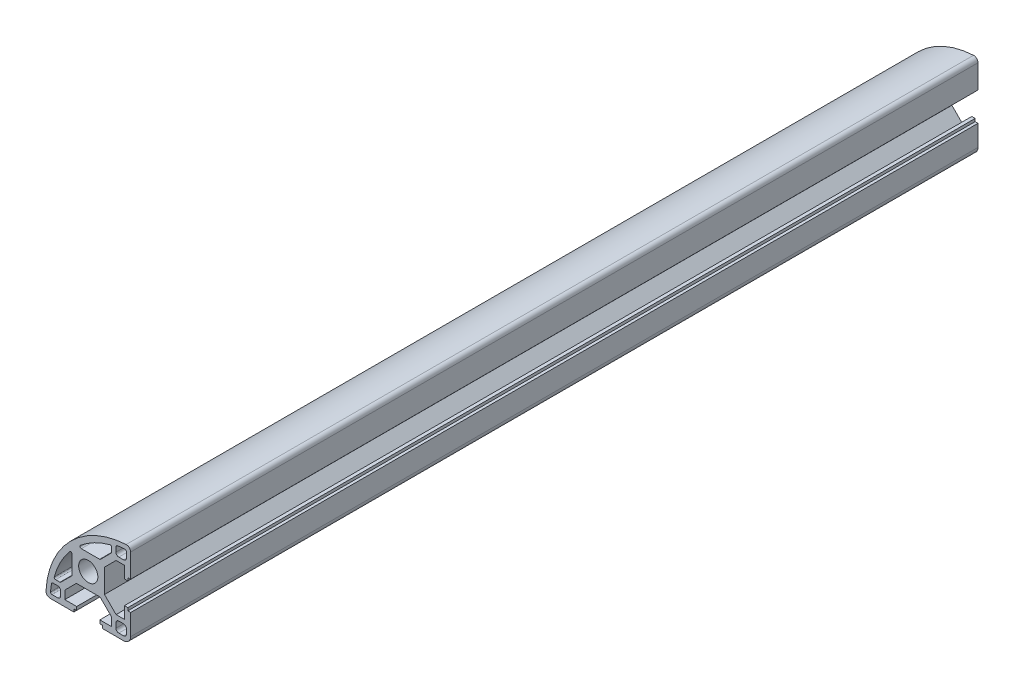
SolidWorks part; units mm, degrees
ref_plane "前视基准面" through (0, 0, 0) normal (0, 0, 1) x (1, 0, 0)
ref_plane "上视基准面" through (0, 0, 0) normal (0, 1, 0) x (1, 0, 0)
ref_plane "右视基准面" through (0, 0, 0) normal (1, 0, 0) x (0, 0, -1)
sketch "草图1" plane through (0, 0, 0) normal (0, 0, 1) x (1, 0, 0)
  line B0 (9.8, -10.8) -> (9.8, -12.5)
  line B1 (10.8, -13.5) -> (12.5, -13.5)
  line B2 (13.5, -12.5) -> (13.5, -10.8)
  line B3 (12.5, -9.8) -> (10.8, -9.8)
  line B4 (-2.4553, 5.75) -> (0, 5.75)
  line B5 (0, 5.75) -> (3.9873, 5.75)
  line B6 (4.3408, 5.8964) -> (8.1536, 9.7092)
  line B7 (8.3, 10.0627) -> (8.3, 11.5407)
  line B8 (9.8, 12.5136) -> (9.8, 10.8)
  line B9 (10.8, 9.8) -> (12.5, 9.8)
  line B10 (13.5, 10.8) -> (13.5, 12.8454)
  line B11 (-11.5407, -8.3) -> (-10.0627, -8.3)
  line B12 (-9.7092, -8.1536) -> (-5.8964, -4.3408)
  line B13 (-5.75, -3.9873) -> (-5.75, 0)
  line B14 (-5.75, 0) -> (-5.75, 2.4553)
  line B15 (-12.8454, -13.5) -> (-10.8, -13.5)
  line B16 (-9.8, -12.5) -> (-9.8, -10.8)
  line B17 (-10.8, -9.8) -> (-12.5136, -9.8)
  line B18 (5.1, -15) -> (12.5, -15)
  line B19 (15, -12.5) -> (15, -5.1)
  line B20 (15, -5.1) -> (14, -5.1)
  line B21 (14, -5.1) -> (14, -4.1)
  line B22 (14, -4.1) -> (12.8, -4.1)
  line B23 (12.8, -4.1) -> (12.8, -8.3)
  line B24 (12.8, -8.3) -> (9.8556, -8.3)
  line B25 (9.8556, -8.3) -> (5.75, -4.1944)
  line B26 (5.75, -4.1944) -> (5.75, 0)
  line B27 (5.75, 0) -> (5.75, 4.1944)
  line B28 (5.75, 4.1944) -> (9.8556, 8.3)
  line B29 (9.8556, 8.3) -> (12.8, 8.3)
  line B30 (12.8, 8.3) -> (12.8, 4.1)
  line B31 (12.8, 4.1) -> (14, 4.1)
  line B32 (14, 4.1) -> (14, 5.1)
  line B33 (14, 5.1) -> (15, 5.1)
  line B34 (15, 5.1) -> (15, 13.4605)
  line B35 (-13.4605, -15) -> (-5.1, -15)
  line B36 (-5.1, -15) -> (-5.1, -14)
  line B37 (-5.1, -14) -> (-4.1, -14)
  line B38 (-4.1, -14) -> (-4.1, -12.8)
  line B39 (-4.1, -12.8) -> (-8.3, -12.8)
  line B40 (-8.3, -12.8) -> (-8.3, -9.8556)
  line B41 (-8.3, -9.8556) -> (-4.1944, -5.75)
  line B42 (-4.1944, -5.75) -> (0, -5.75)
  line B43 (0, -5.75) -> (4.1944, -5.75)
  line B44 (4.1944, -5.75) -> (8.3, -9.8556)
  line B45 (8.3, -9.8556) -> (8.3, -12.8)
  line B46 (8.3, -12.8) -> (4.1, -12.8)
  line B47 (4.1, -12.8) -> (4.1, -14)
  line B48 (4.1, -14) -> (5.1, -14)
  line B49 (5.1, -14) -> (5.1, -15)
  arc B50 (0, 3.4) -> (-3.4, 0) centre (0, 0) ccw
  arc B51 (-3.4, 0) -> (0, -3.4) centre (0, 0) ccw
  arc B52 (0, -3.4) -> (3.4, 0) centre (0, 0) ccw
  arc B53 (3.4, 0) -> (0, 3.4) centre (0, 0) ccw
  arc B54 (10.8, -9.8) -> (9.8, -10.8) centre (10.8, -10.8) ccw
  arc B55 (9.8, -12.5) -> (10.8, -13.5) centre (10.8, -12.5) ccw
  arc B56 (12.5, -13.5) -> (13.5, -12.5) centre (12.5, -12.5) ccw
  arc B57 (13.5, -10.8) -> (12.5, -9.8) centre (12.5, -10.8) ccw
  arc B58 (8.3, 11.5407) -> (7.6691, 12.0233) centre (7.8, 11.5407) ccw
  arc B59 (7.6691, 12.0233) -> (-2.7727, 6.6364) centre (15, -15) ccw
  arc B60 (-2.7727, 6.6364) -> (-2.4553, 5.75) centre (-2.4553, 6.25) ccw
  arc B61 (3.9873, 5.75) -> (4.3408, 5.8964) centre (3.9873, 6.25) ccw
  arc B62 (8.1536, 9.7092) -> (8.3, 10.0627) centre (7.8, 10.0627) ccw
  arc B63 (13.5, 12.8454) -> (12.9636, 13.3441) centre (13, 12.8454) ccw
  arc B64 (12.9636, 13.3441) -> (10.2145, 13.0063) centre (15, -14.5817) ccw
  arc B65 (10.2145, 13.0063) -> (9.8, 12.5136) centre (10.3, 12.5136) ccw
  arc B66 (9.8, 10.8) -> (10.8, 9.8) centre (10.8, 10.8) ccw
  arc B67 (12.5, 9.8) -> (13.5, 10.8) centre (12.5, 10.8) ccw
  arc B68 (-12.0233, -7.6691) -> (-11.5407, -8.3) centre (-11.5407, -7.8) ccw
  arc B69 (-10.0627, -8.3) -> (-9.7092, -8.1536) centre (-10.0627, -7.8) ccw
  arc B70 (-5.8964, -4.3408) -> (-5.75, -3.9873) centre (-6.25, -3.9873) ccw
  arc B71 (-5.75, 2.4553) -> (-6.6364, 2.7727) centre (-6.25, 2.4553) ccw
  arc B72 (-6.6364, 2.7727) -> (-12.0233, -7.6691) centre (15, -15) ccw
  arc B73 (-13.3441, -12.9636) -> (-12.8454, -13.5) centre (-12.8454, -13) ccw
  arc B74 (-10.8, -13.5) -> (-9.8, -12.5) centre (-10.8, -12.5) ccw
  arc B75 (-9.8, -10.8) -> (-10.8, -9.8) centre (-10.8, -10.8) ccw
  arc B76 (-12.5136, -9.8) -> (-13.0063, -10.2145) centre (-12.5136, -10.3) ccw
  arc B77 (-13.0063, -10.2145) -> (-13.3441, -12.9636) centre (14.5817, -15) ccw
  arc B78 (12.5, -15) -> (15, -12.5) centre (12.5, -12.5) ccw
  arc B79 (15, 13.4605) -> (13.4211, 14.9584) centre (13.5, 13.4605) ccw
  arc B80 (13.4211, 14.9584) -> (-6.2132, 6.2132) centre (15, -15) ccw
  arc B81 (-6.2132, 6.2132) -> (-14.9584, -13.4211) centre (15, -15) ccw
  arc B82 (-14.9584, -13.4211) -> (-13.4605, -15) centre (-13.4605, -13.5) ccw
sketch_block_instance "A$C19A24BD6-1"
sketch_block "A$C19A24BD6"
extrude "凸台-拉伸1" add sketch "草图1" along normal blind 300
